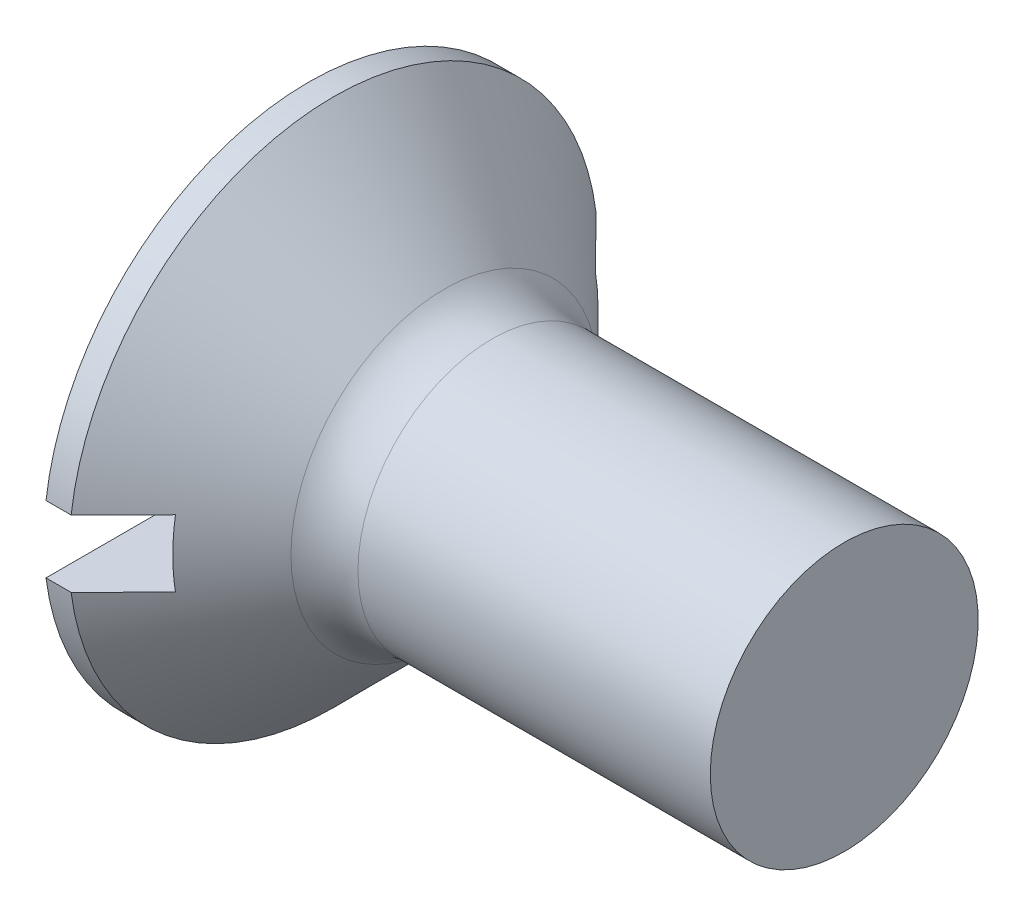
SolidWorks part; units mm, degrees
ref_plane "Plane1" through (0, 0, 0) normal (0, 0, 1) x (1, 0, 0)
ref_plane "Plane2" through (0, 0, 0) normal (0, 1, 0) x (1, 0, 0)
ref_plane "Plane3" through (0, 0, 0) normal (1, 0, 0) x (0, 0, -1)
revolve "Base-Revolve" add sketch "BodySke" angle 360 about L5
sketch "BodySke" plane through (0, 0, 0) normal (0, 0, 1) x (1, 0, 0)
  line L0 (0, 0) -> (0, 7.9)
  line L1 (0, 7.9) -> (0.75, 7.9)
  line L2 (4.65, 4) -> (16, 4)
  line L3 (16, 4) -> (16, 0)
  line L4 (16, 0) -> (0, 0)
  line L5 (-6.35, 0) -> (82.55, 0) construction
  line L6 (4.65, -4) -> (16, -4) construction
  line L7 (0.75, -7.9) -> (4.65, -4) construction
  line L8 (0.75, 7.9) -> (4.65, 4)
  line L9 (0, -7.9) -> (0.75, -7.9) construction
  line L10 (5.9, 5.5875) -> (5.9, -3.9375) construction
  line L11 (0, 6.35) -> (0, -3.175) construction
  dimension "Diameter" = 8
  dimension "Length" = 16
  dimension "Head_ht" = 4.65
  dimension "Head_dia" = 15.8
  dimension "Head_ang" = 90
  dimension "D6" = 0.75
  dimension "Advance" = 1.25
  dimension "Thread_nom" = 16
extrude "Slot" cut sketch "Sketch2" against normal blind 2.3
sketch "Sketch2" plane through (0, 0, 0) normal (-1, 0, 0) x (0, 0, 1)
  line L0 (-7.9, -1) -> (7.9, -1)
  line L1 (-7.9, -1) -> (-7.9, 1)
  line L2 (7.9, 1) -> (-7.9, 1)
  line L3 (7.9, 1) -> (7.9, -1)
  dimension "D1" = 1
  dimension "Slot_width" = 2
  dimension "D2" = 15.8
  dimension "D3" = 7.9
fillet "Fillet1" radius 2 1 edges at (4.65, 0, 4)
sketch "ThdSchSke" plane through (0, 0, 0) normal (0, 0, 1) x (1, 0, 0)
  line L0 (5.9, -3.3095) -> (5.4165, -4)
  line L1 (5.9, -3.3095) -> (6.3835, -4)
  line L2 (6.3835, -4) -> (6.3835, -5)
  line L3 (-3.175, 0) -> (5.1513, 0) construction
  line L5 (6.3835, -5) -> (5.4165, -5)
  line L6 (5.4165, -5) -> (5.4165, -4)
  line L7 (0, 7.9) -> (0, 1) construction
  dimension "Thread_minor" = 6.619
  dimension "Diameter" = 8
  dimension "Start" = 5.9
  dimension "SideAngle" = 55
  dimension "VeeAngle" = 70
  dimension "Overcut" = 10
revolve "ThreadSchematic" cut sketch "ThdSchSke" angle 360 about L3
pattern_linear "ThdSchPat"
equation "\"D1@Sketch2\" = \"Slot_width@Sketch2\" / 2"
equation "\"D2@Sketch2\" = \"Head_dia@BodySke\""
equation "\"D3@Sketch2\" = \"D2@Sketch2\" / 2"
equation "\"Thread_length@ThreadCosmetic\" = ((sgn( (\"Length@BodySke\" - \"Advance@BodySke\" * 1.0 - \"Head_ht@BodySke\" ) - \"Thread_nom@BodySke\" )-1)*( (\"Length@BodySke\" - \"Advance@BodySke\" * 1.0 - \"Head_ht@BodySke\" "
equation "\"Thread_minor@ThdSchSke\" = \"Thread_minor@ThreadCosmetic\""
equation "\"Diameter@ThdSchSke\" = \"Diameter@BodySke\""
equation "\"Overcut@ThdSchSke\" = \"Diameter@BodySke\" * 1.25"
equation "\"Start@ThdSchSke\" = 0.000001 + \"Length@BodySke\" - \"Thread_length@ThreadCosmetic\"  '---Countersunk---"
equation "\"Num_threads@ThdSchPat\" = int( \"Thread_length@ThreadCosmetic\" / \"Advance@BodySke\" + 0.999 )  + 1"
equation "\"Advance@ThdSchPat\" = \"Thread_length@ThreadCosmetic\" /  (\"Num_threads@ThdSchPat\" - 1) 'relax it"
